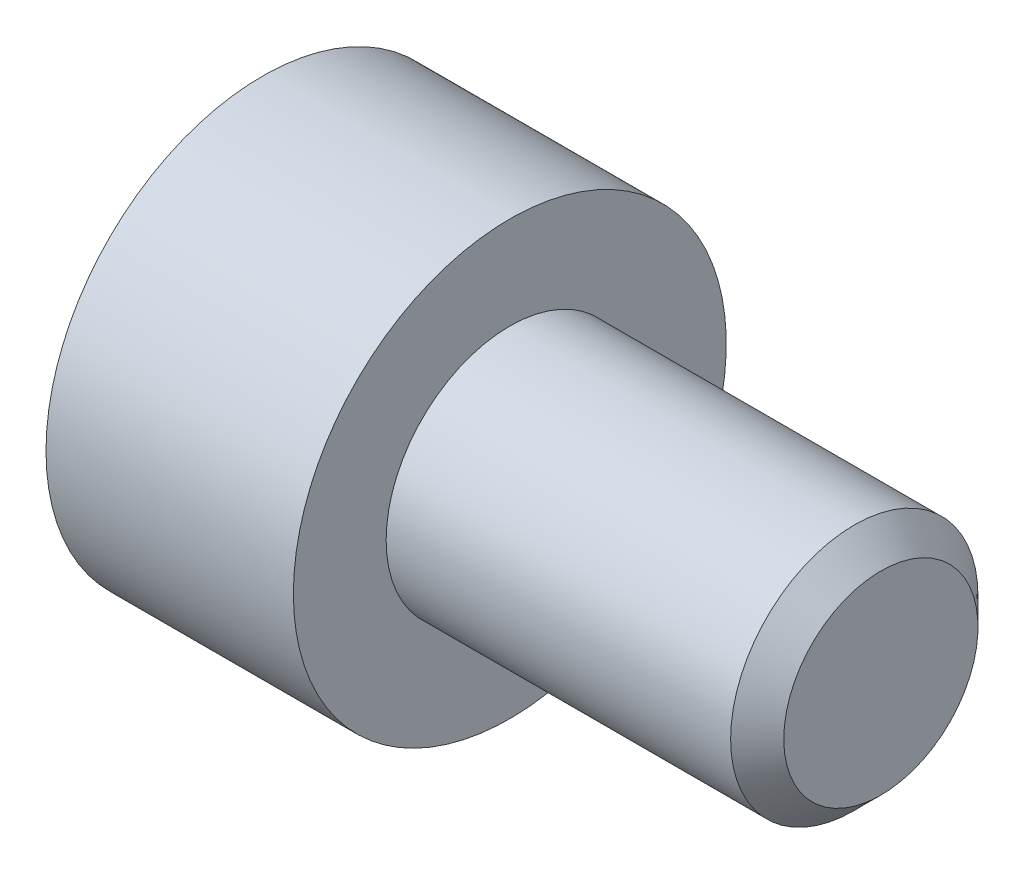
SolidWorks part; units mm, degrees
ref_plane "Face" through (0, 0, 0) normal (0, 0, 1) x (1, 0, 0)
ref_plane "Dessus" through (0, 0, 0) normal (0, 1, 0) x (1, 0, 0)
ref_plane "Droite" through (0, 0, 0) normal (1, 0, 0) x (0, 0, -1)
ref_plane "Plan1" through (0, 0, 0) normal (0, 0, 1) x (1, 0, 0)
sketch "Esquisse1" plane through (0, 0, 0) normal (0, 0, 1) x (1, 0, 0)
  line L0 (-4, 0) -> (-4, 3.5)
  line L1 (-4, 3.5) -> (0, 3.5)
  line L2 (0, 3.5) -> (0, 2)
  line L3 (0, 2) -> (5.5705, 2)
  line L4 (5.5705, 2) -> (6, 1.5705)
  line L5 (6, 1.5705) -> (6, 0)
  line L6 (6, 0) -> (-4, 0)
  line L7 (6, 0) -> (-4, 0) construction
revolve "Révolution1" add sketch "Esquisse1" angle 360 about L7
ref_plane "Plan2" through (-4, 0, 0) normal (1, 0, 0) x (0, 0, -1)
sketch "Esquisse2" plane through (-4, 0, 0) normal (1, 0, 0) x (0, 0, -1)
  line L0 (-1.5, 0.866) -> (-1.5, -0.866)
  line L1 (-1.5, -0.866) -> (0, -1.7321)
  line L2 (0, -1.7321) -> (1.5, -0.866)
  line L3 (1.5, -0.866) -> (1.5, 0.866)
  line L4 (1.5, 0.866) -> (0, 1.7321)
  line L5 (0, 1.7321) -> (-1.5, 0.866)
extrude "Enlèv. mat.-Extru.1" cut sketch "Esquisse2" along normal blind 2
ref_plane "Plan3" through (0, 0, 0) normal (0, 0, 1) x (1, 0, 0)
sketch "Esquisse3" plane through (0, 0, 0) normal (0, 0, 1) x (1, 0, 0)
  line L0 (-2, 0) -> (-2, 1.49)
  line L1 (-2, 1.49) -> (-1.1397, 0)
  line L2 (-1.1397, 0) -> (-2, 0)
  line L3 (-1.1397, 0) -> (-2, 0) construction
revolve "Enlèvement de matière-Révolution1" cut sketch "Esquisse3" angle 360 about L3
